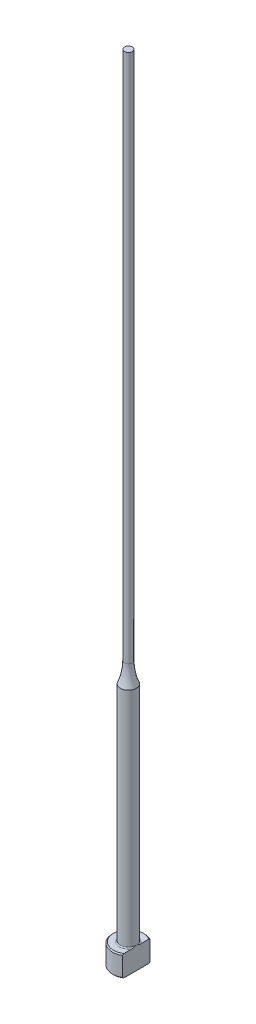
SolidWorks part; units mm, degrees
ref_plane "Front Plane" through (0, 0, 0) normal (0, 0, 1) x (1, 0, 0)
ref_plane "Top Plane" through (0, 0, 0) normal (0, 1, 0) x (1, 0, 0)
ref_plane "Right Plane" through (0, 0, 0) normal (1, 0, 0) x (0, 0, -1)
sketch "Sketch1" plane through (0, 0, 0) normal (0, 0, 1) x (1, 0, 0)
  line L0 (0, 259.9588) -> (0, -15.1925) construction
  line L1 (0, 0) -> (-3, 0)
  line L2 (-3, 0) -> (-3, 4)
  line L3 (-3, 4) -> (-1.5, 4)
  line L4 (-0.75, 50) -> (-0.75, 150)
  line L5 (-0.75, 150) -> (0, 150)
  line L6 (0, 150) -> (0, 0)
  line L7 (-1.5, 4) -> (-1.5, 46.2003)
  arc A0 (-1.5, 46.2003) -> (-0.75, 50) centre (-10.75, 50) ccw
  point P13 (-1.5, 0)
  dimension "D1" = 10
  dimension "L" = 150
  dimension "H" = 6
  dimension "T" = 4
  dimension "D" = 1.5
  dimension "B" = 3
  dimension "S" = 50
revolve "Revolve1" add sketch "Sketch1" angle 360 about L0
chamfer "Chamfer1" distance 0.2 angle 45 2 edges at (0, 4, 3) (0, 0, 3)
fillet "Fillet1" radius 0.2 1 edges at (0, 4, 1.5)
sketch "Sketch2" plane through (0, 0, 0) normal (0, 1, 0) x (1, 0, 0)
  line L0 (1.5, -2.5981) -> (1.5, 2.5981)
  circle A0 centre (0, 0) radius 3 construction
  arc A1 (1.5, -2.5981) -> (1.5, 2.5981) centre (0, 0) ccw
  circle A2 centre (0, 0) radius 1.5 construction
extrude "Keyed Head" cut sketch "Sketch2" along normal through all
